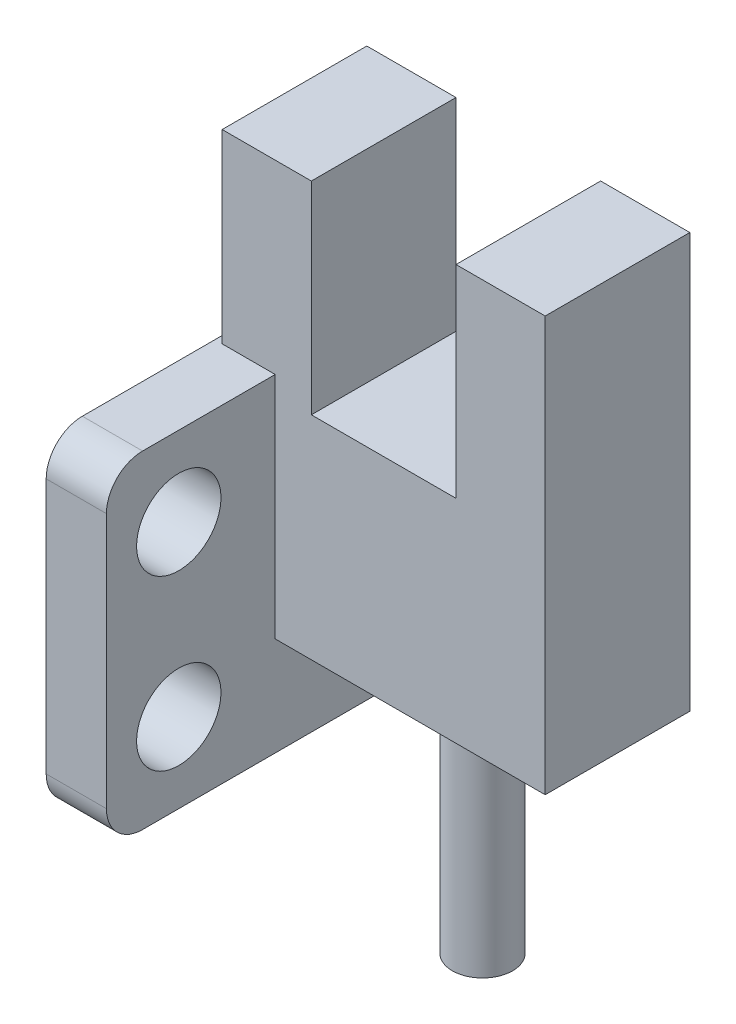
SolidWorks part; units mm, degrees
ref_plane "前视基准面" through (0, 0, 0) normal (0, 0, 1) x (1, 0, 0)
ref_plane "上视基准面" through (0, 0, 0) normal (0, 1, 0) x (1, 0, 0)
ref_plane "右视基准面" through (0, 0, 0) normal (1, 0, 0) x (0, 0, -1)
sketch "草图1" plane through (0, 0, 0) normal (0, 0, 1) x (1, 0, 0)
  line L0 (0, 0) -> (0, 17.2)
  line L1 (0, 17.2) -> (3.7, 17.2)
  line L2 (3.7, 17.2) -> (3.7, 8.8)
  line L3 (3.7, 8.8) -> (9.7, 8.8)
  line L4 (9.7, 8.8) -> (9.7, 17.2)
  line L5 (9.7, 17.2) -> (13.4, 17.2)
  line L6 (13.4, 17.2) -> (13.4, 0)
  line L7 (13.4, 0) -> (0, 0)
extrude "凸台-拉伸1" add sketch "草图1" along normal blind 6
sketch "草图2" plane through (0, 0, 0) normal (-1, 0, 0) x (0, 0, 1)
  line L0 (0, 0) -> (0, -4.1)
  line L1 (0, -4.1) -> (13, -4.1)
  line L2 (13, -4.1) -> (13, 9.5)
  line L3 (13, 9.5) -> (0, 9.5)
  line L4 (0, 17.2) -> (0, 0) construction
  line L5 (0, 9.5) -> (0, 0)
extrude "凸台-拉伸2" add sketch "草图2" against normal blind 2.2
sketch "草图3" plane through (0, 0, 0) normal (-1, 0, 0) x (0, 0, 1)
  line L0 (0, -4.1) -> (13, -4.1)
  line L1 (13, -4.1) -> (13, 9.5)
  line L2 (13, 9.5) -> (0, 9.5)
  line L3 (0, 17.2) -> (0, -4.1) construction
  line L4 (0, 9.5) -> (0, -4.1)
extrude "凸台-拉伸3" add sketch "草图3" along normal blind 0.3
sketch "草图4" plane through (-0.3, 0, 0) normal (-1, 0, 0) x (0, 0, 1)
  circle A0 centre (10, 6.2) radius 1.75
  circle A1 centre (10, -0.8) radius 1.75
extrude "切除-拉伸1" cut sketch "草图4" against normal blind 2.5
fillet "圆角2" radius 1.5 3 edges at (0.95, -4.1, 0) (0.95, -4.1, 13) (0.95, 9.5, 13)
sketch "草图5" plane through (0, 0, 0) normal (0, -1, 0) x (1, 0, 0)
  circle A0 centre (7.8, 3) radius 1.25
extrude "凸台-拉伸4" add sketch "草图5" along normal blind 10
